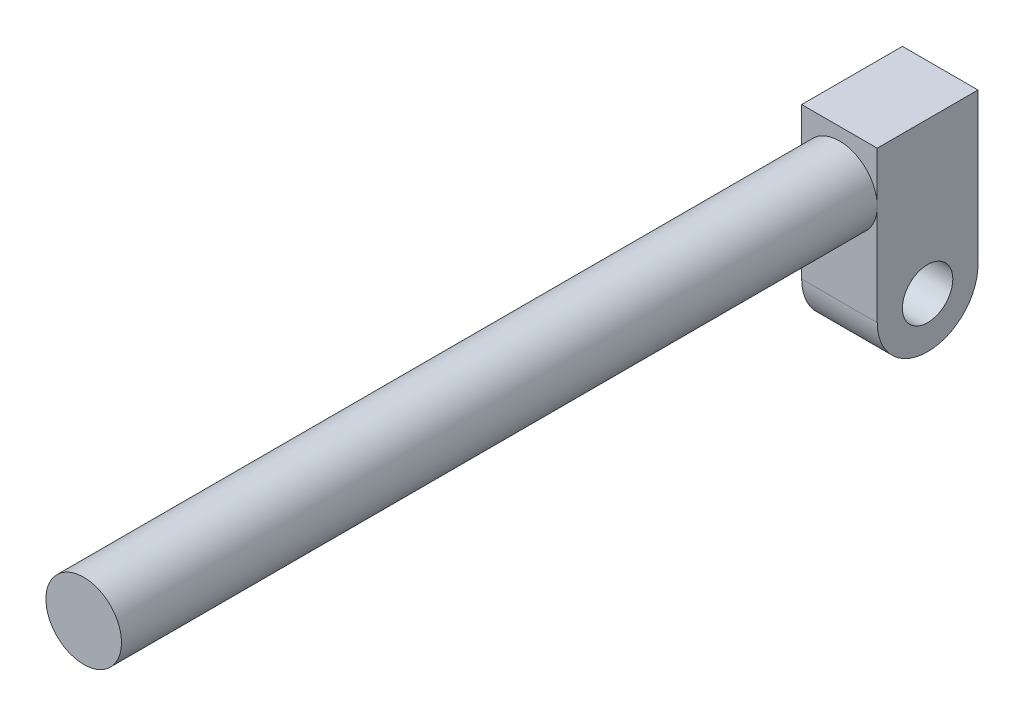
SolidWorks part; units mm, degrees
ref_plane "Front Plane" through (0, 0, 0) normal (0, 0, 1) x (1, 0, 0)
ref_plane "Top Plane" through (0, 0, 0) normal (0, 1, 0) x (1, 0, 0)
ref_plane "Right Plane" through (0, 0, 0) normal (1, 0, 0) x (0, 0, -1)
sketch "Sketch1" plane through (0, 0, 0) normal (1, 0, 0) x (0, 0, -1)
  line L0 (-40, 0) -> (-40, 120)
  line L1 (-40, 120) -> (40, 120)
  line L2 (40, 120) -> (40, 0)
  circle A0 centre (0, 0) radius 20
  circle A1 centre (0, 0) radius 40
  dimension "D1" = 40
  dimension "D2" = 80
  dimension "D3" = 120
extrude "Boss-Extrude1" add sketch "Sketch1" along normal mid plane 60 contours A1 L2 L1 L0 | A1 A0
sketch "Sketch2" plane through (0, 0, 40) normal (0, 0, 1) x (1, 0, 0)
  line L0 (0, 0) -> (0, 80) construction
  line L1 (30, 0) -> (-30, 0) construction
  line L2 (30, 120) -> (-30, 120) construction
  circle A0 centre (0, 80) radius 40
  circle A1 centre (0, 80) radius 30
  dimension "D1" = 80
  dimension "D2" = 60
extrude "Boss-Extrude3" add sketch "Sketch2" along normal blind 600
